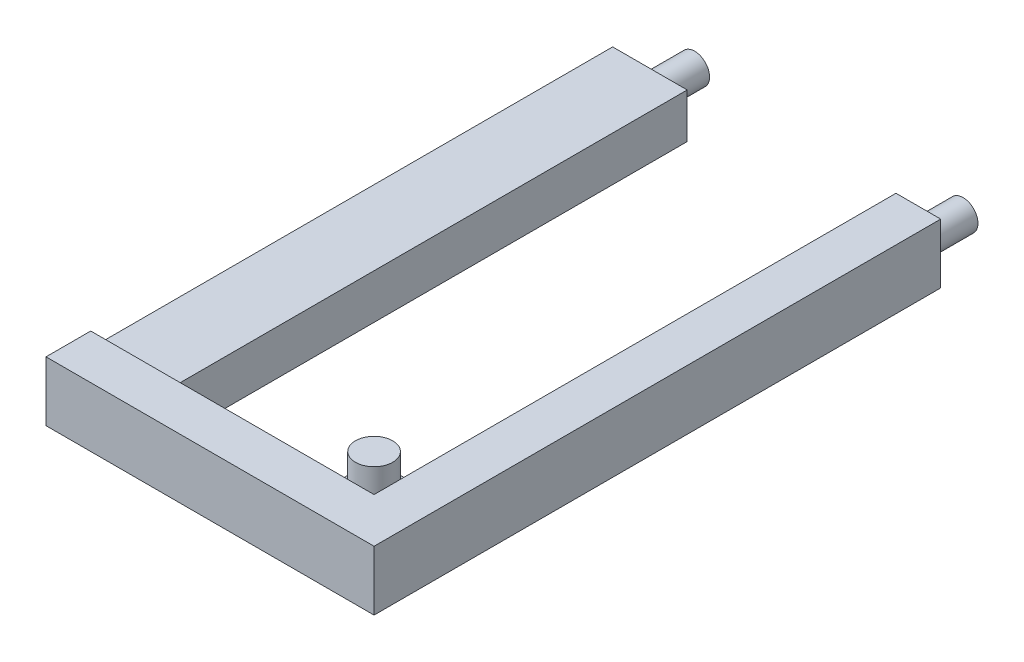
SolidWorks part; units mm, degrees
ref_plane "Alzado" through (0, 0, 0) normal (0, 0, 1) x (1, 0, 0)
ref_plane "Planta" through (0, 0, 0) normal (0, 1, 0) x (1, 0, 0)
ref_plane "Vista lateral" through (0, 0, 0) normal (1, 0, 0) x (0, 0, -1)
sketch "Croquis1" plane through (0, 0, 0) normal (0, 1, 0) x (1, 0, 0)
  line L1 (-2.5, -17.5) -> (2.5, -17.5)
  line L2 (-2.5, -17.5) -> (-2.5, 17.5)
  line L3 (-2.5, 17.5) -> (2.5, 17.5)
  line L4 (2.5, -17.5) -> (2.5, 17.5)
  line L5 (-2.5, -17.5) -> (2.5, 17.5) construction
  line L6 (-2.5, 17.5) -> (2.5, -17.5) construction
  point P0 (0, 0)
  dimension "D1" = 5
  dimension "D2" = 35
extrude "Saliente-Extruir1" add sketch "Croquis1" along normal blind 3
sketch "Croquis3" plane through (0, 0, 17.5) normal (0, 0, 1) x (1, 0, 0)
  line L1 (-2.5, 0) -> (16.5, 0)
  line L2 (-2.5, 0) -> (-2.5, 4)
  line L3 (-2.5, 4) -> (16.5, 4)
  line L4 (16.5, 0) -> (16.5, 4)
  dimension "D1" = 4
  dimension "D2" = 19
extrude "Saliente-Extruir2" add sketch "Croquis3" along normal blind 3
sketch "Croquis4" plane through (0, 4, 0) normal (0, 1, 0) x (1, 0, 0)
  line L5 (16.5, -17.5) -> (11.5, -17.5)
  line L6 (16.5, -17.5) -> (16.5, -12.5)
  line L7 (16.5, -12.5) -> (11.5, -12.5)
  line L8 (11.5, -17.5) -> (11.5, -12.5)
  dimension "D1" = 5
extrude "Saliente-Extruir5" add sketch "Croquis4" against normal blind 4
sketch "Croquis6" plane through (0, 4, 0) normal (0, 1, 0) x (1, 0, 0)
  line L0 (11.5, -17.5) -> (16.5, -12.5) construction
  line L2 (11.5, -17.5) -> (16.5, -17.5)
  line L3 (11.5, -17.5) -> (11.5, -12.5)
  line L4 (11.5, -12.5) -> (16.5, -12.5)
  line L5 (16.5, -17.5) -> (16.5, -12.5)
  circle A0 centre (14, -15) radius 1.25
  dimension "D1" = 2.5
extrude "Cortar-Extruir1" cut sketch "Croquis6" against normal blind 3
sketch "Croquis11" plane through (16.5, 0, 0) normal (1, 0, 0) x (0, 0, -1)
  line L1 (-20.5, 0) -> (17.5, 0)
  line L2 (-20.5, 0) -> (-20.5, 4)
  line L3 (-20.5, 4) -> (17.5, 4)
  line L4 (17.5, 0) -> (17.5, 4)
  dimension "D1" = 38
  dimension "D2" = 4
extrude "Saliente-Extruir8" add sketch "Croquis11" along normal blind 3
sketch "Croquis12" plane through (0, 0, -17.5) normal (0, 0, -1) x (-1, 0, 0)
  line L0 (-19.5, 4) -> (-16.5, 0) construction
  line L1 (-2.5, 3) -> (2.5, 0) construction
  line L2 (-19.5, 4) -> (-16.5, 4) construction
  line L3 (-19.5, 0) -> (-19.5, 4) construction
  line L4 (2.5, 3) -> (-2.5, 3) construction
  line L5 (2.5, 3) -> (2.5, 0) construction
  circle A0 centre (-18, 2) radius 1
  circle A1 centre (0, 1.5) radius 1
  dimension "D1" = 2
  dimension "D2" = 2
extrude "Saliente-Extruir9" add sketch "Croquis12" along normal blind 3
